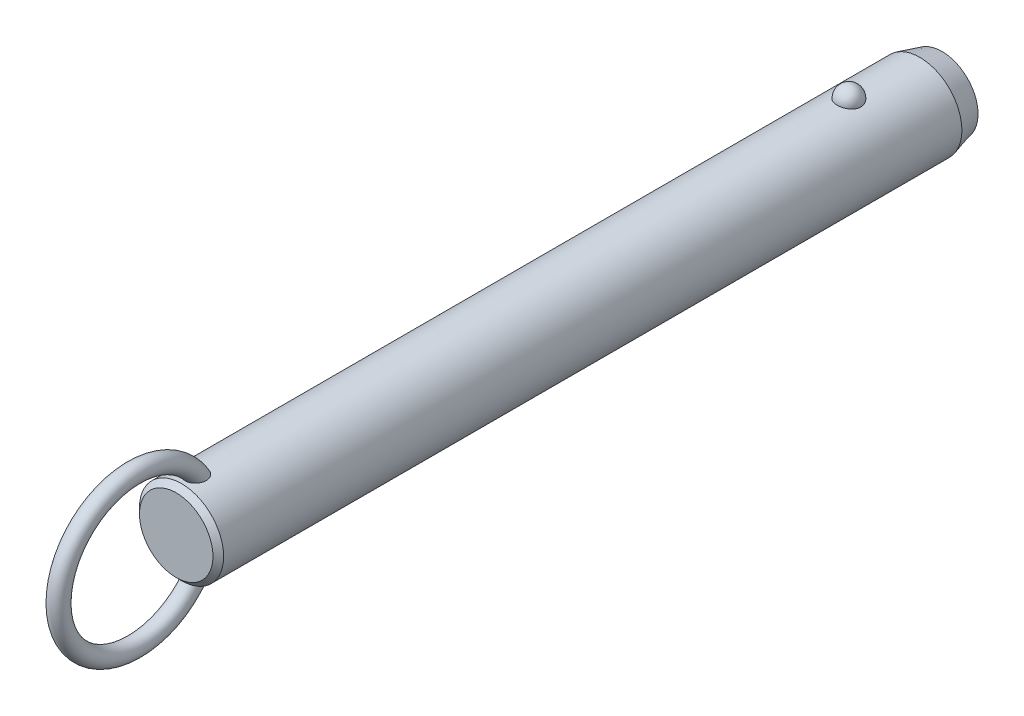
SolidWorks part; units mm, degrees
ref_plane "Front Plane" through (0, 0, 0) normal (0, 0, 1) x (1, 0, 0)
ref_plane "Top Plane" through (0, 0, 0) normal (0, 1, 0) x (1, 0, 0)
ref_plane "Right Plane" through (0, 0, 0) normal (1, 0, 0) x (0, 0, -1)
sketch "Sketch2" plane through (0, 0, 0) normal (0, 0, 1) x (1, 0, 0)
  circle A0 centre (0, 0) radius 9.5
  point P3 (0, 9.5)
  dimension "D1" = 19
extrude "Boss-Extrude1" add sketch "Sketch2" along normal blind 139.7
sketch "Sketch3" plane through (0, 0, 0) normal (0, 0, -1) x (-1, 0, 0)
  circle A0 centre (0, 0) radius 9.5
  dimension "D1" = 19
extrude "Boss-Extrude2" add sketch "Sketch3" along normal blind 23.7
chamfer "Chamfer1" distance 5 angle 15 1 edges at (-9.5, 0, -23.7)
sketch "Sketch12" plane through (0, 0, 0) normal (1, 0, 0) x (0, 0, -1)
  line L0 (-139.7, 9.5) -> (-139.7, -9.5) construction
  point P0 (-139.7, 0)
sketch "Sketch13" plane through (0, 0, 0) normal (1, 0, 0) x (0, 0, -1)
  circle A0 centre (-158.75, 0) radius 19.05
  point P2 (-139.7, 0)
  dimension "D1" = 38.1
sketch "Sketch14" plane through (0, 0, 0) normal (0, 1, 0) x (1, 0, 0)
  circle A0 centre (0, -141.7) radius 2
  point P2 (0, -139.7)
  dimension "D1" = 4
sweep "Sweep1" add profiles "Sketch14" path "Sketch13"
sketch "Sketch15" plane through (0, 0, 139.7) normal (0, 0, 1) x (1, 0, 0)
  circle A0 centre (0, 0) radius 9.5
  dimension "D1" = 19
extrude "Boss-Extrude3" add sketch "Sketch15" along normal blind 9.52
chamfer "Chamfer2" distance 1.2 angle 45 1 edges at (9.5, 0, 149.22)
sketch "Sketch18" plane through (0, 0, 0) normal (1, 0, 0) x (0, 0, -1)
  line L0 (18.7, 9.5) -> (-142.2378, 9.5) construction
  line L1 (2.7, 12.2) -> (2.7, 6.8)
  line L2 (-142.2378, -9.5) -> (18.7, -9.5) construction
  arc A0 (2.7, 12.2) -> (2.7, 6.8) centre (2.7, 9.5) ccw
  point P4 (0, 9.5)
  dimension "D1" = 21.7
revolve "Revolve1" add sketch "Sketch18" angle 360 about L1
